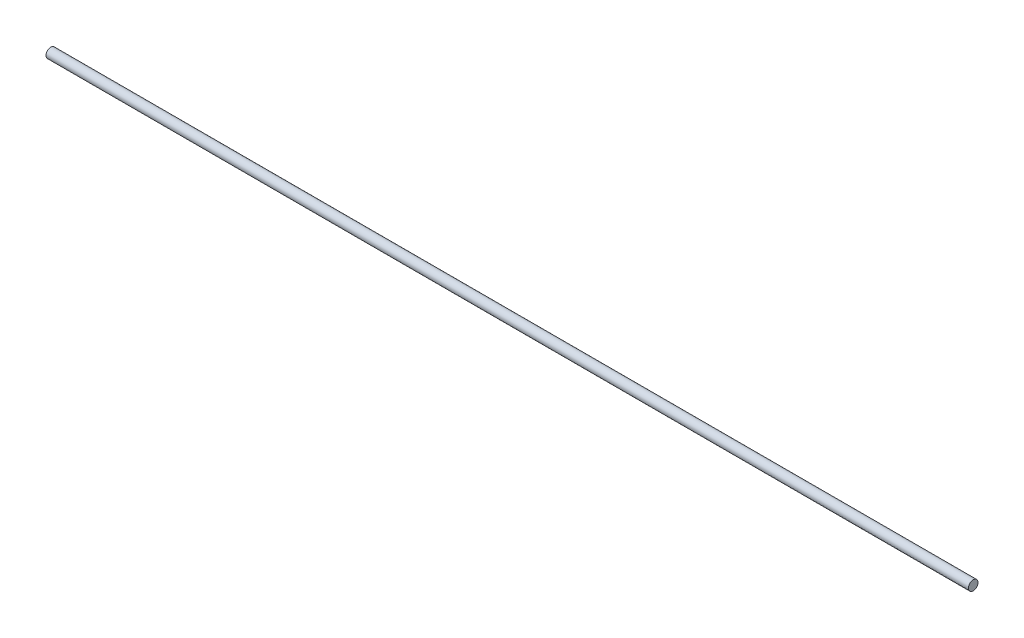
SolidWorks part; units mm, degrees
ref_plane "Front Plane" through (0, 0, 0) normal (0, 0, 1) x (1, 0, 0)
ref_plane "Top Plane" through (0, 0, 0) normal (0, 1, 0) x (1, 0, 0)
ref_plane "Right Plane" through (0, 0, 0) normal (1, 0, 0) x (0, 0, -1)
sketch "Sketch2" plane through (0, 0, 0) normal (1, 0, 0) x (0, 0, -1)
  circle A0 centre (0, 0) radius 6.35
extrude "Boss-Extrude1" add sketch "Sketch2" along normal blind 1219.2 contours A0
